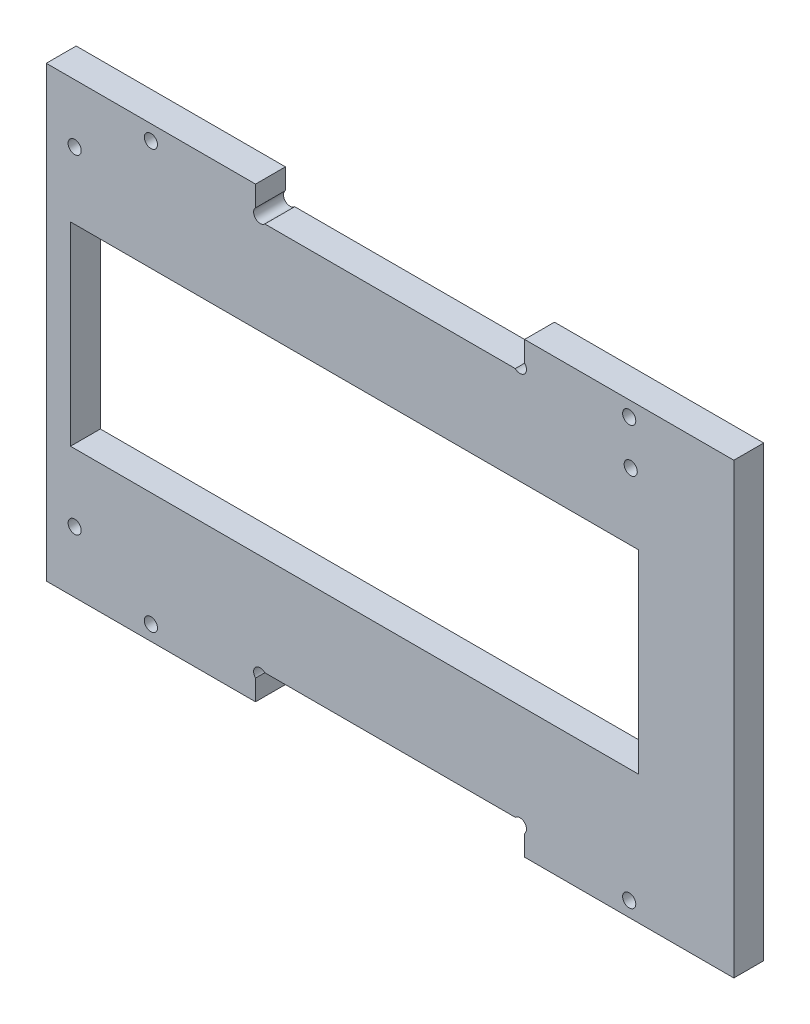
SolidWorks part; units mm, degrees
ref_plane "Plan de face" through (0, 0, 0) normal (0, 0, 1) x (1, 0, 0)
ref_plane "Plan de dessus" through (0, 0, 0) normal (0, 1, 0) x (1, 0, 0)
ref_plane "Plan de droite" through (0, 0, 0) normal (1, 0, 0) x (0, 0, -1)
sketch "Esquisse1" plane through (0, 0, 0) normal (0, 0, 1) x (1, 0, 0)
  line L1 (0, 0) -> (115, 0)
  line L2 (0, 0) -> (0, 75)
  line L3 (0, 75) -> (115, 75)
  line L4 (115, 0) -> (115, 75)
  dimension "D1" = 115
  dimension "D2" = 75
extrude "Boss.-Extru.1" add sketch "Esquisse1" along normal blind 5
sketch "Esquisse2" plane through (0, 0, 5) normal (0, 0, 1) x (1, 0, 0)
  line L0 (0, 75) -> (0, 0) construction
  line L1 (4.05, 21.55) -> (99.05, 21.55)
  line L2 (4.05, 21.55) -> (4.05, 54.05)
  line L3 (4.05, 54.05) -> (99.05, 54.05)
  line L4 (99.05, 21.55) -> (99.05, 54.05)
  line L5 (115, 75) -> (0, 75) construction
  dimension "D1" = 95
  dimension "D2" = 32.5
  dimension "D3" = 4.05
  dimension "D4" = 20.95
extrude "Enlèv. mat.-Extru.1" cut sketch "Esquisse2" against normal up to next
sketch "Esquisse3" plane through (0, 0, 5) normal (0, 0, 1) x (1, 0, 0)
  line L0 (0, 75) -> (0, 0) construction
  line L1 (115, 75) -> (0, 75) construction
  circle A0 centre (4.75, 65.25) radius 1.1
  circle A1 centre (97.75, 65.25) radius 1.1
  circle A2 centre (4.75, 10.25) radius 1.1
  dimension "D1" = 2.2
  dimension "D2" = 2.2
  dimension "D3" = 2.2
  dimension "D6" = 93
  dimension "D7" = 55
  dimension "D4" = 4.75
  dimension "D5" = 9.75
extrude "Enlèv. mat.-Extru.2" cut sketch "Esquisse3" against normal up to next
sketch "Esquisse4" plane through (0, 0, 5) normal (0, 0, 1) x (1, 0, 0)
  circle A0 centre (4.75, 65.25) radius 2
  circle A1 centre (97.75, 65.25) radius 2
  circle A2 centre (4.75, 10.25) radius 2
  dimension "D1" = 4
  dimension "D2" = 4
  dimension "D3" = 4
extrude "Enlèv. mat.-Extru.3" [suppressed] cut sketch "Esquisse4" against normal blind 1.5
sketch "Esquisse5" plane through (0, 0, 5) normal (0, 0, 1) x (1, 0, 0)
  line L0 (115, 75) -> (0, 75) construction
  line L1 (35, 75) -> (80, 75)
  line L2 (35, 75) -> (35, 70)
  line L3 (35, 70) -> (80, 70)
  line L4 (80, 75) -> (80, 70)
  line L5 (0, 0) -> (115, 0) construction
  line L6 (80, 0) -> (35, 0)
  line L7 (80, 0) -> (80, 5)
  line L8 (80, 5) -> (35, 5)
  line L9 (35, 0) -> (35, 5)
  line L10 (0, 75) -> (0, 0) construction
  dimension "D1" = 45
  dimension "D2" = 45
  dimension "D3" = 5
  dimension "D4" = 5
  dimension "D5" = 35
  dimension "D6" = 35
extrude "Enlèv. mat.-Extru.4" cut sketch "Esquisse5" against normal up to next
sketch "Esquisse6" plane through (0, 0, 5) normal (0, 0, 1) x (1, 0, 0)
  line L0 (35, 70) -> (51.871, 86.871) construction
  line L1 (80, 70) -> (63.4787, 86.5213) construction
  line L2 (80, 5) -> (62.7192, -12.2808) construction
  line L3 (35, 5) -> (51.052, -11.052) construction
  line L4 (35, 70) -> (80, 70) construction
  line L5 (80, 5) -> (35, 5) construction
  circle A0 centre (35.7778, 70.7778) radius 1.1
  circle A1 centre (79.2222, 70.7778) radius 1.1
  circle A2 centre (35.7778, 4.2222) radius 1.1
  circle A3 centre (79.2222, 4.2222) radius 1.1
  dimension "D5" = 2.2
  dimension "D6" = 2.2
  dimension "D7" = 2.2
  dimension "D8" = 2.2
  dimension "D1" = 45
  dimension "D2" = 45
  dimension "D3" = 45
  dimension "D4" = 45
extrude "Enlèv. mat.-Extru.5" cut sketch "Esquisse6" against normal up to next
sketch "Esquisse7" plane through (0, 0, 0) normal (0, 0, -1) x (-1, 0, 0)
  line L0 (-78.4444, 5) -> (-36.5556, 5) construction
  line L1 (-92.75, 13.5) -> (-52.75, 13.5)
  line L2 (-92.75, 13.5) -> (-92.75, 7.5)
  line L3 (-92.75, 7.5) -> (-52.75, 7.5)
  line L4 (-52.75, 13.5) -> (-52.75, 7.5)
  circle A0 centre (-97.75, 65.25) radius 1.1 construction
  dimension "D1" = 40
  dimension "D2" = 6
  dimension "D3" = 5
  dimension "D4" = 2.5
extrude "Enlèv. mat.-Extru.6" cut sketch "Esquisse7" against normal blind 1
ref_plane "Plan1" through (0, 37.5, 0) normal (0, 1, 0) x (-1, 0, 0)
ref_plane "Plan2" through (57.5, 0, 0) normal (-1, 0, 0) x (0, 0, 1)
sketch "Esquisse8" plane through (0, 0, 5) normal (0, 0, 1) x (1, 0, 0)
  line L0 (115, 75) -> (80, 75) construction
  line L1 (97.5, 75) -> (97.5, 68.1187) construction
  circle A0 centre (97.5, 72.5) radius 1.1
  dimension "D1" = 2.2
  dimension "D2" = 2.5
extrude "Enlèv. mat.-Extru.7" cut sketch "Esquisse8" against normal up to next
mirror "Symétrie1" about plane through (57.5, 0, 0) normal (-1, 0, 0) of "Enlèv. mat.-Extru.7"
mirror "Symétrie2" about plane through (0, 37.5, 0) normal (0, 1, 0) of "Symétrie1", "Enlèv. mat.-Extru.7"
